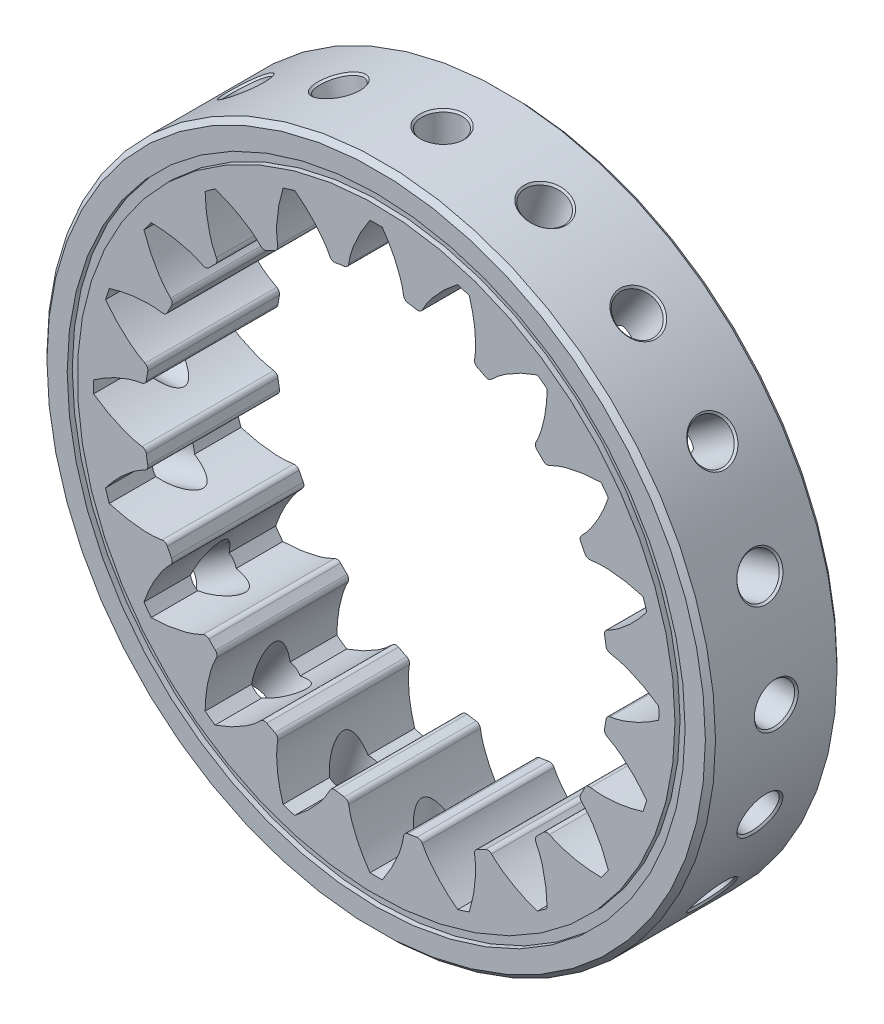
SolidWorks part; units mm, degrees
ref_plane "Front Plane" through (0, 0, 0) normal (0, 0, 1) x (1, 0, 0)
ref_plane "Top Plane" through (0, 0, 0) normal (0, 1, 0) x (1, 0, 0)
ref_plane "Right Plane" through (0, 0, 0) normal (1, 0, 0) x (0, 0, -1)
curve "Curve1"
sketch "Sketch1" plane through (0, 0, 0) normal (0, 0, 1) x (1, 0, 0)
  line L0 (0, 0) -> (-45.0724, 0) construction
  arc A21 (-22.7341, 2.7515) -> (-22.4717, 4.4084) centre (0, 0) cw
  arc A41 (-27.8935, 0.6021) -> (-27.8935, -0.6021) centre (0, 0) ccw
  arc A42 (-20.7711, 9.6421) -> (-20.0096, 11.1367) centre (0, 0) cw
  arc A43 (-26.3422, 9.1922) -> (-26.7144, 8.0469) centre (0, 0) ccw
  arc A44 (-16.775, 15.5888) -> (-15.5888, 16.775) centre (0, 0) cw
  arc A45 (-22.2124, 16.8825) -> (-22.9202, 15.9083) centre (0, 0) ccw
  arc A46 (-11.1367, 20.0096) -> (-9.6421, 20.7711) centre (0, 0) cw
  arc A47 (-15.9083, 22.9202) -> (-16.8825, 22.2124) centre (0, 0) ccw
  arc A48 (-4.4084, 22.4717) -> (-2.7515, 22.7341) centre (0, 0) cw
  arc A49 (-8.0469, 26.7144) -> (-9.1922, 26.3422) centre (0, 0) ccw
  arc A50 (2.7515, 22.7341) -> (4.4084, 22.4717) centre (0, 0) cw
  arc A51 (0.6021, 27.8935) -> (-0.6021, 27.8935) centre (0, 0) ccw
  arc A52 (9.6421, 20.7711) -> (11.1367, 20.0096) centre (0, 0) cw
  arc A53 (9.1922, 26.3422) -> (8.0469, 26.7144) centre (0, 0) ccw
  arc A54 (15.5888, 16.775) -> (16.775, 15.5888) centre (0, 0) cw
  arc A55 (16.8825, 22.2124) -> (15.9083, 22.9202) centre (0, 0) ccw
  arc A56 (20.0096, 11.1367) -> (20.7711, 9.6421) centre (0, 0) cw
  arc A57 (22.9202, 15.9083) -> (22.2124, 16.8825) centre (0, 0) ccw
  arc A58 (22.4717, 4.4084) -> (22.7341, 2.7515) centre (0, 0) cw
  arc A59 (26.7144, 8.0469) -> (26.3422, 9.1922) centre (0, 0) ccw
  arc A60 (22.7341, -2.7515) -> (22.4717, -4.4084) centre (0, 0) cw
  arc A61 (27.8935, -0.6021) -> (27.8935, 0.6021) centre (0, 0) ccw
  arc A62 (20.7711, -9.6421) -> (20.0096, -11.1367) centre (0, 0) cw
  arc A63 (26.3422, -9.1922) -> (26.7144, -8.0469) centre (0, 0) ccw
  arc A64 (16.775, -15.5888) -> (15.5888, -16.775) centre (0, 0) cw
  arc A65 (22.2124, -16.8825) -> (22.9202, -15.9083) centre (0, 0) ccw
  arc A66 (11.1367, -20.0096) -> (9.6421, -20.7711) centre (0, 0) cw
  arc A67 (15.9083, -22.9202) -> (16.8825, -22.2124) centre (0, 0) ccw
  arc A68 (4.4084, -22.4717) -> (2.7515, -22.7341) centre (0, 0) cw
  arc A69 (8.0469, -26.7144) -> (9.1922, -26.3422) centre (0, 0) ccw
  arc A70 (-2.7515, -22.7341) -> (-4.4084, -22.4717) centre (0, 0) cw
  arc A71 (-0.6021, -27.8935) -> (0.6021, -27.8935) centre (0, 0) ccw
  arc A72 (-9.6421, -20.7711) -> (-11.1367, -20.0096) centre (0, 0) cw
  arc A73 (-9.1922, -26.3422) -> (-8.0469, -26.7144) centre (0, 0) ccw
  arc A74 (-15.5888, -16.775) -> (-16.775, -15.5888) centre (0, 0) cw
  arc A75 (-16.8825, -22.2124) -> (-15.9083, -22.9202) centre (0, 0) ccw
  arc A76 (-20.0096, -11.1367) -> (-20.7711, -9.6421) centre (0, 0) cw
  arc A77 (-22.9202, -15.9083) -> (-22.2124, -16.8825) centre (0, 0) ccw
  arc A78 (-22.4717, -4.4084) -> (-22.7341, -2.7515) centre (0, 0) cw
  arc A79 (-26.7144, -8.0469) -> (-26.3422, -9.1922) centre (0, 0) ccw
  circle A80 centre (0, 0) radius 33
  spline S0 degree 3 number of poles 313 (-28.3316, 0.1424) -> (-22.7341, 2.7515) construction
  spline S1 degree 3 number of poles 294 (-27.8935, 0.6021) -> (-22.7341, 2.7515)
  spline S2 degree 3 number of poles 294 (-27.8935, -0.6021) -> (-22.7341, -2.7515)
  spline S3 degree 3 number of poles 294 (-26.3422, 9.1922) -> (-20.7711, 9.6421)
  spline S4 degree 3 number of poles 294 (-26.7144, 8.0469) -> (-22.4717, 4.4084)
  spline S5 degree 3 number of poles 294 (-22.2124, 16.8825) -> (-16.775, 15.5888)
  spline S6 degree 3 number of poles 294 (-22.9202, 15.9083) -> (-20.0096, 11.1367)
  spline S7 degree 3 number of poles 294 (-15.9083, 22.9202) -> (-11.1367, 20.0096)
  spline S8 degree 3 number of poles 294 (-16.8825, 22.2124) -> (-15.5888, 16.775)
  spline S9 degree 3 number of poles 294 (-8.0469, 26.7144) -> (-4.4084, 22.4717)
  spline S10 degree 3 number of poles 294 (-9.1922, 26.3422) -> (-9.6421, 20.7711)
  spline S11 degree 3 number of poles 294 (0.6021, 27.8935) -> (2.7515, 22.7341)
  spline S12 degree 3 number of poles 294 (-0.6021, 27.8935) -> (-2.7515, 22.7341)
  spline S13 degree 3 number of poles 294 (9.1922, 26.3422) -> (9.6421, 20.7711)
  spline S14 degree 3 number of poles 294 (8.0469, 26.7144) -> (4.4084, 22.4717)
  spline S15 degree 3 number of poles 294 (16.8825, 22.2124) -> (15.5888, 16.775)
  spline S16 degree 3 number of poles 294 (15.9083, 22.9202) -> (11.1367, 20.0096)
  spline S17 degree 3 number of poles 294 (22.9202, 15.9083) -> (20.0096, 11.1367)
  spline S18 degree 3 number of poles 294 (22.2124, 16.8825) -> (16.775, 15.5888)
  spline S19 degree 3 number of poles 294 (26.7144, 8.0469) -> (22.4717, 4.4084)
  spline S20 degree 3 number of poles 294 (26.3422, 9.1922) -> (20.7711, 9.6421)
  spline S21 degree 3 number of poles 294 (27.8935, -0.6021) -> (22.7341, -2.7515)
  spline S22 degree 3 number of poles 294 (27.8935, 0.6021) -> (22.7341, 2.7515)
  spline S23 degree 3 number of poles 294 (26.3422, -9.1922) -> (20.7711, -9.6421)
  spline S24 degree 3 number of poles 294 (26.7144, -8.0469) -> (22.4717, -4.4084)
  spline S25 degree 3 number of poles 294 (22.2124, -16.8825) -> (16.775, -15.5888)
  spline S26 degree 3 number of poles 294 (22.9202, -15.9083) -> (20.0096, -11.1367)
  spline S27 degree 3 number of poles 294 (15.9083, -22.9202) -> (11.1367, -20.0096)
  spline S28 degree 3 number of poles 294 (16.8825, -22.2124) -> (15.5888, -16.775)
  spline S29 degree 3 number of poles 294 (8.0469, -26.7144) -> (4.4084, -22.4717)
  spline S30 degree 3 number of poles 294 (9.1922, -26.3422) -> (9.6421, -20.7711)
  spline S31 degree 3 number of poles 294 (-0.6021, -27.8935) -> (-2.7515, -22.7341)
  spline S32 degree 3 number of poles 294 (0.6021, -27.8935) -> (2.7515, -22.7341)
  spline S33 degree 3 number of poles 294 (-9.1922, -26.3422) -> (-9.6421, -20.7711)
  spline S34 degree 3 number of poles 294 (-8.0469, -26.7144) -> (-4.4084, -22.4717)
  spline S35 degree 3 number of poles 294 (-16.8825, -22.2124) -> (-15.5888, -16.775)
  spline S36 degree 3 number of poles 294 (-15.9083, -22.9202) -> (-11.1367, -20.0096)
  spline S37 degree 3 number of poles 294 (-22.9202, -15.9083) -> (-20.0096, -11.1367)
  spline S38 degree 3 number of poles 294 (-22.2124, -16.8825) -> (-16.775, -15.5888)
  spline S39 degree 3 number of poles 294 (-26.7144, -8.0469) -> (-22.4717, -4.4084)
  spline S40 degree 3 number of poles 294 (-26.3422, -9.1922) -> (-20.7711, -9.6421)
  point P86 (0, 0)
  point P108 (0, 0)
  dimension "D3" = 27.9
  dimension "D2" = 20
extrude "Boss-Extrude1" add sketch "Sketch1" along normal mid plane 13
fillet "Fillet1" radius 0.5 40 edges at (-22.7341, 2.7515, 0) (-22.4717, 4.4084, 0) (-22.7341, -2.7515, 0) (-22.4717, -4.4084, 0) (-20.7711, -9.6421, 0) (-20.0096, -11.1367, 0) (-16.775, -15.5888, 0) (-15.5888, -16.775, 0) (-11.1367, -20.0096, 0) (-9.6421, -20.7711, 0) (-4.4084, -22.4717, 0) (-2.7515, -22.7341, 0) (2.7515, -22.7341, 0) (4.4084, -22.4717, 0) (9.6421, -20.7711, 0) (11.1367, -20.0096, 0) (15.5888, -16.775, 0) (16.775, -15.5888, 0) (20.0096, -11.1367, 0) (20.7711, -9.6421, 0) (22.4717, -4.4084, 0) (22.7341, -2.7515, 0) (22.7341, 2.7515, 0) (22.4717, 4.4084, 0) (20.7711, 9.6421, 0) (20.0096, 11.1367, 0) (16.775, 15.5888, 0) (15.5888, 16.775, 0) (11.1367, 20.0096, 0) (9.6421, 20.7711, 0) (4.4084, 22.4717, 0) (2.7515, 22.7341, 0) (-2.7515, 22.7341, 0) (-4.4084, 22.4717, 0) (-20.0096, 11.1367, 0) (-20.7711, 9.6421, 0) (-15.5888, 16.775, 0) (-16.775, 15.5888, 0) (-9.6421, 20.7711, 0) (-11.1367, 20.0096, 0)
sketch "Sketch2" plane through (0, 0, 0) normal (0, 1, 0) x (1, 0, 0)
  circle A0 centre (0, 0) radius 2
  dimension "D1" = 4
extrude "Cut-Extrude1" cut sketch "Sketch2" against normal through all
chamfer "Chamfer1" distance 0.2 angle 45 1 edges at (-0.4559, -32.9969, -1.9473)
pattern_circular "CirPattern1" count 20 over 360 about axis through (0, 0, 6.5) along (0, 0, -1) of "Cut-Extrude1", "Chamfer1"
chamfer "Smusso1" distance 0.5 angle 45 2 edges at (33, 0, -6.5) (33, 0, 6.5)
sketch "Schizzo2" plane through (0, 0, 0) normal (0, 1, 0) x (1, 0, 0)
  line L0 (0, 0) -> (0, 11.1552) construction
  line L1 (-30.5, 6) -> (-30.5, -6) construction
  line L2 (-30.5, 8) -> (-29.5, 8)
  line L3 (-30.5, 8) -> (-30.5, 6)
  line L4 (-30.5, 6) -> (-29.5, 6)
  line L5 (-29.5, 8) -> (-29.5, 6)
  line L6 (-30.5, -6) -> (-29.5, -6)
  line L7 (-30.5, -6) -> (-30.5, -8)
  line L8 (-30.5, -8) -> (-29.5, -8)
  line L9 (-29.5, -6) -> (-29.5, -8)
  line L10 (-29.5, 6) -> (-29.5, -6) construction
  point P11 (-30, 6)
  dimension "D1" = 2
  dimension "D2" = 2
  dimension "D3" = 6
  dimension "D4" = 6
  dimension "D5" = 1
  dimension "D6" = 30.5
revolve "Taglia-Rivoluzione1" cut sketch "Schizzo2" angle 360 about L0
